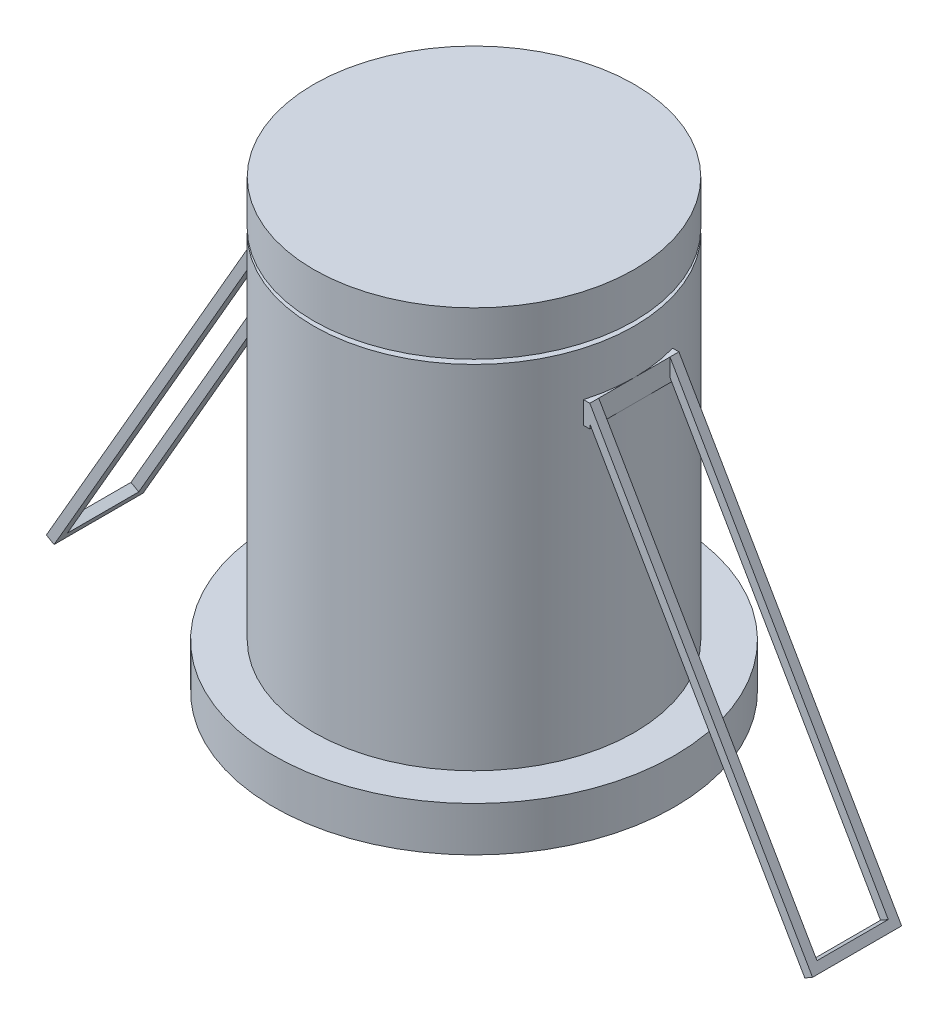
SolidWorks part; units mm, degrees
ref_plane "Alzado" through (0, 0, 0) normal (0, 0, 1) x (1, 0, 0)
ref_plane "Planta" through (0, 0, 0) normal (0, 1, 0) x (1, 0, 0)
ref_plane "Vista lateral" through (0, 0, 0) normal (1, 0, 0) x (0, 0, -1)
sketch "Croquis1" plane through (0, 0, 0) normal (0, 0, 1) x (1, 0, 0)
  line L0 (-15, 0) -> (-22.5, 0)
  line L1 (-22.5, 0) -> (-22.5, 5)
  line L2 (-22.5, 5) -> (-18, 5)
  line L4 (0, 15) -> (0, 50) construction
  line L6 (-18, 5) -> (-18, 44.5)
  line L7 (-18, 50) -> (0, 50)
  line L8 (0, 50) -> (0, 15)
  line L10 (-15, 0) -> (-15, 15)
  line L11 (-15, 15) -> (0, 15)
  line L13 (-18, 50) -> (-18, 45)
  line L14 (-18, 45) -> (-17, 45)
  line L15 (-17, 45) -> (-17, 44.5)
  line L16 (-17, 44.5) -> (-18, 44.5)
  line L17 (-18, 45) -> (-18, 50)
revolve "Revolución1" add sketch "Croquis1" angle 360 about L4
ref_plane "Plano1" through (18, 0, 0) normal (1, 0, 0) x (0, 0, -1)
sketch "Croquis2" plane through (18, 0, 0) normal (1, 0, 0) x (0, 0, -1)
  line L0 (0, 44.5) -> (0, 39.5) construction
  line L1 (18, 44.5) -> (-18, 44.5) construction
  line L3 (-5, 37) -> (5, 37)
  line L4 (5, 37) -> (5, 39.5)
  line L5 (5, 39.5) -> (-5, 39.5)
  line L6 (-5, 39.5) -> (-5, 37)
  point P9 (0, 37)
  dimension "D1" = 5
extrude "Saliente-Extruir1" add sketch "Croquis2" against normal up to surface (0.7084 mm away)
ref_plane "Plano2" through (30.604, 17.6692, 0) normal (0.866, 0.5, 0) x (0, 0, 1)
sketch "Croquis3" plane through (30.604, 17.6692, 0) normal (0.866, 0.5, 0) x (0, 0, 1)
  line L0 (4, -25.208) -> (4, 23.792)
  line L2 (5, -25.208) -> (5, 24.792)
  line L3 (5, 24.792) -> (-5, 24.792)
  line L4 (-5, -25.208) -> (-5, 24.792)
  line L5 (4, 23.792) -> (-4, 23.792)
  line L6 (-4, -25.208) -> (-4, 23.792)
  line L7 (-5, -25.208) -> (-4, -25.208)
  line L8 (4, -25.208) -> (5, -25.208)
  dimension "D1" = 50
  dimension "D2" = 1
extrude "Saliente-Extruir2" add sketch "Croquis3" against normal blind 1
mirror "Simetría1" about plane through (0, 0, 0) normal (1, 0, 0) of "Saliente-Extruir2", "Saliente-Extruir1"
